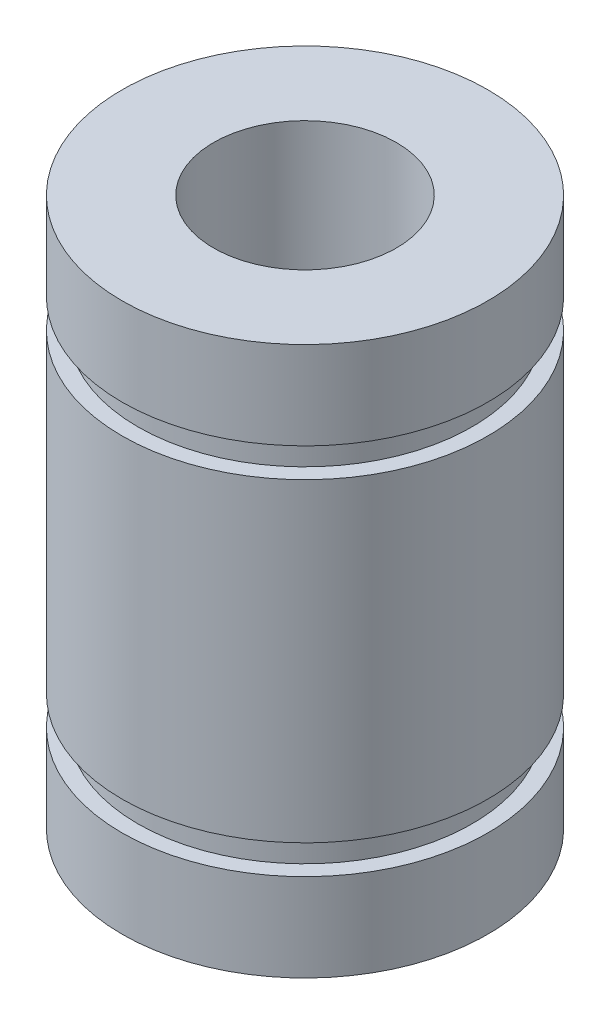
SolidWorks part; units mm, degrees
ref_plane "Front Plane" through (0, 0, 0) normal (0, 0, 1) x (1, 0, 0)
ref_plane "Top Plane" through (0, 0, 0) normal (0, 1, 0) x (1, 0, 0)
ref_plane "Right Plane" through (0, 0, 0) normal (1, 0, 0) x (0, 0, -1)
sketch "Sketch1" plane through (0, 0, 0) normal (0, 1, 0) x (1, 0, 0)
  circle A0 centre (0, 0) radius 6.35
  circle A1 centre (0, 0) radius 3.175
  dimension "D1" = 12.7
  dimension "D2" = 6.35
extrude "Boss-Extrude1" add sketch "Sketch1" along normal blind 19.05
sketch "Sketch2" plane through (0, 0, 0) normal (0, 0, 1) x (1, 0, 0)
  line L0 (0, 0) -> (0, 19.05) construction
  line L1 (-6.35, 0) -> (6.35, 0) construction
  line L2 (3.175, 19.05) -> (-3.175, 19.05) construction
  line L3 (-6.35, 0) -> (-6.35, 19.05)
  line L4 (6.35, 19.05) -> (6.35, 0)
  line L5 (6.35, 19.05) -> (6.35, 0) construction
  line L6 (-6.35, 0) -> (-6.35, 19.05) construction
  line L7 (-6.35, 3.048) -> (-6.35, 16.002) construction
  line L8 (-6.35, 9.525) -> (0, 9.525) construction
  line L9 (-6.35, 16.002) -> (-5.8033, 16.002)
  line L10 (-6.35, 16.002) -> (-6.35, 14.986)
  line L11 (-6.35, 14.986) -> (-5.8033, 14.986)
  line L12 (-5.8033, 16.002) -> (-5.8033, 14.986)
  line L13 (-5.8033, 3.048) -> (-5.8033, 4.064)
  line L14 (-6.35, 4.064) -> (-5.8033, 4.064)
  line L15 (-6.35, 3.048) -> (-6.35, 4.064)
  line L16 (-6.35, 3.048) -> (-5.8033, 3.048)
  point P13 (-6.35, 9.525)
  dimension "D1" = 12.954
  dimension "D2" = 0.5467
  dimension "D3" = 1.016
revolve "Cut-Revolve1" cut sketch "Sketch2" angle 360 about L0
